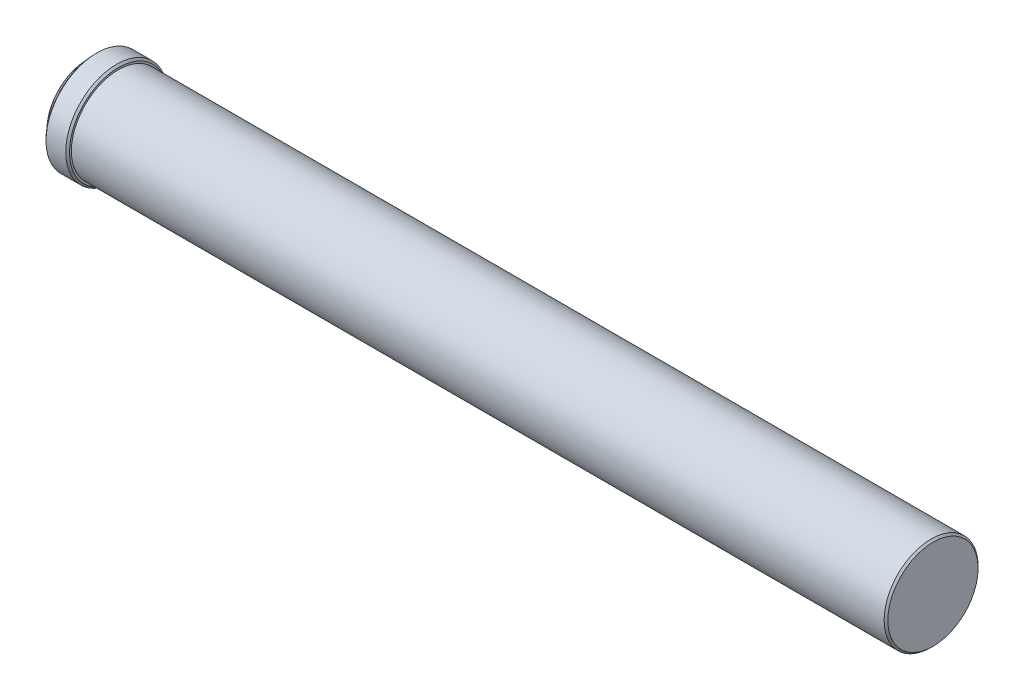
SolidWorks part; units mm, degrees
ref_plane "Plan de face" through (0, 0, 0) normal (0, 0, 1) x (1, 0, 0)
ref_plane "Plan de dessus" through (0, 0, 0) normal (0, 1, 0) x (1, 0, 0)
ref_plane "Plan de droite" through (0, 0, 0) normal (1, 0, 0) x (0, 0, -1)
sketch "Esquisse1" plane through (0, 0, 0) normal (0, 0, 1) x (1, 0, 0)
  line L0 (0, 0) -> (0, 48)
  line L1 (-2, 50) -> (-867, 50)
  line L2 (-867, 52) -> (-867, 50)
  line L3 (-894, 44) -> (-899, 44)
  line L4 (-900, 43) -> (-900, 0)
  line L5 (-900, 0) -> (0, 0)
  line L6 (-869, 54) -> (-890, 54)
  line L7 (-899, 44) -> (-900, 43)
  line L8 (0, 48) -> (-2, 50)
  line L9 (-892, 52) -> (-892, 46)
  line L10 (-892, 46) -> (-894, 44)
  line L11 (-890, 54) -> (-892, 52)
  line L12 (-867, 52) -> (-869, 54)
  point P1 (0, 50)
  point P3 (-900, 44)
  point P8 (-867, 54)
  point P13 (-892, 54)
  point P14 (-892, 44)
  dimension "D1" = 50
  dimension "D2" = 33
  dimension "D3" = 900
  dimension "D4" = 44
  dimension "D5" = 54
  dimension "D6" = 25
  dimension "D7" = 1
  dimension "D8" = 45
  dimension "D9" = 2
  dimension "D10" = 45
  dimension "D11" = 2
  dimension "D12" = 45
  dimension "D13" = 2
  dimension "D14" = 45
  dimension "D15" = 2
  dimension "D16" = 45
revolve "Révolution1" add sketch "Esquisse1" angle 360 about L5
